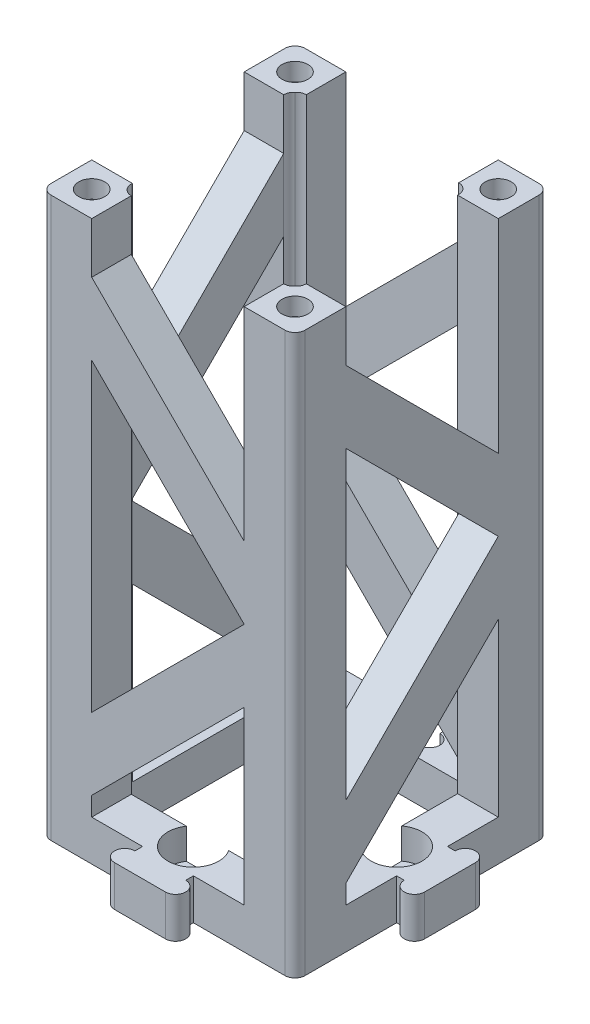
SolidWorks part; units mm, degrees
ref_plane "Front Plane" through (0, 0, 0) normal (0, 0, 1) x (1, 0, 0)
ref_plane "Top Plane" through (0, 0, 0) normal (0, 1, 0) x (1, 0, 0)
ref_plane "Right Plane" through (0, 0, 0) normal (1, 0, 0) x (0, 0, -1)
sketch "Sketch2" plane through (0, 0, 0) normal (0, 1, 0) x (1, 0, 0)
  line L0 (0, -25) -> (0, -20) construction
  line L1 (23, -25) -> (-23, -25)
  line L2 (25, -23) -> (25, 23)
  line L3 (23, 25) -> (5, 25)
  line L4 (-25, -23) -> (-25, -5)
  line L5 (25, -25) -> (-25, 25) construction
  line L6 (25, 25) -> (-25, -25) construction
  line L7 (15, -17.2179) -> (1.25, -17.2179)
  line L8 (17, -15.2179) -> (17, -1.25)
  line L9 (15, 17.2179) -> (-15, 17.2179)
  line L10 (-17, -15.2179) -> (-17, 15.2179)
  line L11 (17, -17.2179) -> (-17, 17.2179) construction
  line L12 (17, 17.2179) -> (-17, -17.2179) construction
  line L13 (25, 0) -> (20, 0) construction
  line L14 (25, 5) -> (26.5, 5)
  line L15 (25, 0) -> (33.3042, 0) construction
  line L16 (25, -5) -> (26.5, -5)
  line L17 (30.5, 5) -> (30.5, -5)
  line L18 (5, -30.5) -> (-5, -30.5)
  line L19 (-5, -25) -> (-5, -26.5)
  line L20 (0, 0) -> (25, -5) construction
  line L21 (0, 0) -> (-5, -25) construction
  line L22 (5, -26.5) -> (5, -25)
  line L23 (0, 25) -> (0, 17.2179) construction
  line L24 (-5, 25) -> (-5, 23.5)
  line L25 (5, 25) -> (5, 23.5)
  line L26 (-5, 19.5) -> (5, 19.5)
  line L27 (-5, 25) -> (-23, 25)
  line L28 (-19.5, -5) -> (-19.5, 5)
  line L29 (-25, 5) -> (-23.5, 5)
  line L30 (-25, -5) -> (-23.5, -5)
  line L31 (-25, 5) -> (-25, 23)
  line L32 (17, 1.25) -> (17, 15.2179)
  line L33 (-1.25, -17.2179) -> (-15, -17.2179)
  arc A0 (23, -25) -> (25, -23) centre (23, -23) ccw
  arc A1 (25, 23) -> (23, 25) centre (23, 23) ccw
  arc A2 (17, 15.2179) -> (15, 17.2179) centre (15, 15.2179) ccw
  arc A3 (15, -17.2179) -> (17, -15.2179) centre (15, -15.2179) ccw
  arc A4 (-15, -17.2179) -> (-17, -15.2179) centre (-15, -15.2179) cw
  arc A5 (-23, -25) -> (-25, -23) centre (-23, -23) cw
  arc A6 (-15, 17.2179) -> (-17, 15.2179) centre (-15, 15.2179) ccw
  arc A7 (-23, 25) -> (-25, 23) centre (-23, 23) ccw
  arc A8 (-1.25, -17.2179) -> (1.25, -17.2179) centre (0, -20) ccw
  arc A9 (17, -1.25) -> (17, 1.25) centre (20, 0) ccw
  arc A10 (26.5, 5) -> (30.5, 5) centre (28.5, 5) cw
  arc A11 (26.5, -5) -> (30.5, -5) centre (28.5, -5) ccw
  arc A12 (-5, -26.5) -> (-5, -30.5) centre (-5, -28.5) ccw
  arc A13 (5, -26.5) -> (5, -30.5) centre (5, -28.5) cw
  arc A14 (-5, 23.5) -> (-5, 19.5) centre (-5, 21.5) ccw
  arc A15 (5, 23.5) -> (5, 19.5) centre (5, 21.5) cw
  arc A16 (-23.5, -5) -> (-19.5, -5) centre (-21.5, -5) ccw
  arc A17 (-23.5, 5) -> (-19.5, 5) centre (-21.5, 5) cw
  circle A18 centre (-20, -20) radius 2.55
  circle A19 centre (-20, 20) radius 2.55
  circle A20 centre (20, 20) radius 2.55
  circle A21 centre (20, -20) radius 2.55
  point P0 (0, 0)
  point P6 (0, 0)
  point P82 (0, 0)
  point P91 (0, 0)
  dimension "D4" = 2
  dimension "D8" = 2
  dimension "D9" = 5.5
  dimension "D14" = 2
  dimension "D20" = 2
  dimension "D25" = 2
  dimension "D26" = 5.1
  dimension "D27" = 5.1
  dimension "D33" = 6.1
  dimension "D34" = 6.5
  dimension "D1" = 50
  dimension "D2" = 50
  dimension "D3" = 34
  dimension "D5" = 5
  dimension "D6" = 5
  dimension "D7" = 10
  dimension "D10" = 2
  dimension "D11" = 90
  dimension "D12" = 1.5
  dimension "D13" = 10
  dimension "D15" = 10
  dimension "D16" = 5
  dimension "D17" = 5
  dimension "D18" = 10
  dimension "D19" = 1.5
  dimension "D22" = 1.5
  dimension "D23" = 20
  dimension "D24" = 10
  dimension "D28" = 5
  dimension "D29" = 4
  dimension "D30" = 5
  dimension "D31" = 5
  dimension "D32" = 5
  dimension "D35" = 13.75
  dimension "D21" = 2
extrude "Boss-Extrude2" add sketch "Sketch2" along normal blind 8 contours L29 A17 L28 A16 L30 L4 A5 L1 A0 L2 A1 L3 L25 A15 L26 A14 L24 L27 A7 L31 A21 A20 A19 A18 A9 L8 A3 L7 A8 L33 A4 L10 A6 L9 A2 L32 | A13 L22 L1 L19 A12 L18 | L16 A11 L17 A10 L14 L2
sketch "Sketch3" plane through (0, 8, 0) normal (0, 1, 0) x (1, 0, 0)
  circle A0 centre (0, -20) radius 5
  circle A1 centre (20, 0) radius 5
  dimension "D1" = 10
extrude "Cut-Extrude1" cut sketch "Sketch3" against normal blind 6
sketch "Sketch5" plane through (0, 0, 0) normal (0, -1, 0) x (1, 0, 0)
  circle A0 centre (-20, 20) radius 3
  circle A1 centre (20, 20) radius 3
  circle A2 centre (20, -20) radius 3
  circle A3 centre (-20, -20) radius 3
  dimension "D1" = 6
extrude "Boss-Extrude3" add sketch "Sketch5" against normal blind 4.5
sketch "Sketch6" plane through (0, 8, 0) normal (0, 1, 0) x (1, 0, 0)
  line L0 (-5, -25) -> (-23, -25) construction
  line L1 (-17, -15) -> (-25, -15)
  line L2 (-15, -17.2179) -> (-15, -25)
  line L3 (-15, -25) -> (-23, -25)
  line L4 (-25, -15) -> (-25, -23)
  line L5 (-16.519, -16.519) -> (-24.4142, -24.4142) construction
  line L6 (-15, -25) -> (-25, -15) construction
  line L7 (-25, -23) -> (-25, -5) construction
  line L8 (-4.1545, -17.2179) -> (-15, -17.2179) construction
  line L9 (-17, -15.2179) -> (-17, 15.2179) construction
  line L10 (-4.1545, -17.2179) -> (-15, -17.2179)
  line L11 (-17, -15.2179) -> (-17, -15)
  line L12 (-15.2179, 17) -> (-15, 17)
  line L13 (-15, 17) -> (-15, 25)
  line L14 (-15, 25) -> (-23, 25)
  line L15 (-25, 15) -> (-25, 23)
  line L16 (-17.2179, 15) -> (-25, 15)
  line L17 (17, 15.2179) -> (17, 15)
  line L18 (17, 15) -> (25, 15)
  line L19 (25, 15) -> (25, 23)
  line L20 (15, 25) -> (23, 25)
  line L21 (15, 17.2179) -> (15, 25)
  line L22 (15.2179, -17) -> (15, -17)
  line L23 (15, -17) -> (15, -25)
  line L24 (15, -25) -> (23, -25)
  line L25 (25, -15) -> (25, -23)
  line L26 (17.2179, -15) -> (25, -15)
  arc A0 (-25, -23) -> (-23, -25) centre (-23, -23) ccw construction
  arc A1 (-17, -15.2179) -> (-15, -17.2179) centre (-15, -15.2179) ccw construction
  arc A2 (-25, -23) -> (-23, -25) centre (-23, -23) ccw
  arc A3 (-17, -15.2179) -> (-15, -17.2179) centre (-15, -15.2179) ccw
  circle A4 centre (0, 0) radius 9.4075 construction
  arc A5 (-15.2179, 17) -> (-17.2179, 15) centre (-15.2179, 15) ccw
  arc A6 (-23, 25) -> (-25, 23) centre (-23, 23) ccw
  arc A7 (17, 15.2179) -> (15, 17.2179) centre (15, 15.2179) ccw
  arc A8 (25, 23) -> (23, 25) centre (23, 23) ccw
  arc A9 (15.2179, -17) -> (17.2179, -15) centre (15.2179, -15) ccw
  arc A10 (23, -25) -> (25, -23) centre (23, -23) ccw
  point P0 (-20, -20)
  point P52 (0, 0)
  dimension "D1" = 4
extrude "Boss-Extrude4" add sketch "Sketch6" along normal blind 102 contours L2 L1 M11 M12 M30 M31 M32 M24 | A9 L23 L26 M19 M38 M39 M40 M21 | L21 L18 M15 M16 M46 M47 M48 M22 | A5 L13 L16 M13 M54 M55 M56 M23
sketch "Sketch7" plane through (0, 8, 0) normal (0, 1, 0) x (1, 0, 0)
  circle A0 centre (-20, 20) radius 2.55
  circle A1 centre (-20, -20) radius 2.55
  circle A2 centre (20, -20) radius 2.55
  circle A3 centre (20, 20) radius 2.55
extrude "Boss-Extrude5" add sketch "Sketch7" along normal blind 98.5
sketch "Sketch8" plane through (25, 0, 0) normal (1, 0, 0) x (0, 0, -1)
  line L0 (-15, 8) -> (-15, 59) construction
  line L1 (-15, 110) -> (-15, 8) construction
  line L2 (-15, 11.7157) -> (15, 41.7157)
  line L3 (15, 110) -> (15, 8) construction
  line L4 (15, 41.7157) -> (15, 55.8579)
  line L5 (15, 70) -> (-15, 100)
  line L6 (-15, 25.8579) -> (15, 55.8579)
  line L7 (-15, 11.7157) -> (-15, 25.8579)
  line L8 (15, 55.8579) -> (-15, 85.8579)
  line L10 (-15, 100) -> (-15, 85.8579)
  line L11 (15, 70) -> (15, 55.8579)
  dimension "D1" = 10
  dimension "D2" = 10
  dimension "D3" = 135
  dimension "D4" = 45
  dimension "D5" = 10
extrude "Boss-Extrude8" add sketch "Sketch8" against normal up to vertex (10 mm away) contours L11 L5 L4 L8 | L6 L4 L2
sketch "Sketch12" plane through (0, 0, -25) normal (0, 0, -1) x (-1, 0, 0)
  line L0 (-15, 8) -> (-15, 59) construction
  line L1 (-15, 11.7157) -> (15, 41.7157)
  line L2 (15, 41.7157) -> (15, 55.8579)
  line L3 (15, 70) -> (-15, 100)
  line L4 (-15, 25.8579) -> (15, 55.8579)
  line L5 (-15, 11.7157) -> (-15, 25.8579)
  line L6 (15, 55.8579) -> (-15, 85.8579)
  line L7 (-15, 100) -> (-15, 85.8579)
  line L8 (15, 70) -> (15, 55.8579)
  line L9 (15, 110) -> (15, 8) construction
  line L10 (-15, 110) -> (-15, 8) construction
  dimension "D1" = 10
  dimension "D2" = 135
  dimension "D3" = 10
  dimension "D4" = 10
  dimension "D5" = 45
extrude "Boss-Extrude9" add sketch "Sketch12" against normal up to vertex (7.7821 mm away) contours L4 L1 L2 M12 | L6 L7 L3 L8
sketch "Sketch13" plane through (-25, 0, 0) normal (-1, 0, 0) x (0, 0, 1)
  line L0 (-15, 8) -> (-15, 59) construction
  line L1 (-15, 11.7157) -> (15, 41.7157)
  line L2 (15, 41.7157) -> (15, 55.8579)
  line L3 (15, 70) -> (-15, 100)
  line L4 (-15, 25.8579) -> (15, 55.8579)
  line L5 (-15, 11.7157) -> (-15, 25.8579)
  line L6 (15, 55.8579) -> (-15, 85.8579)
  line L7 (-15, 100) -> (-15, 85.8579)
  line L8 (15, 70) -> (15, 55.8579)
  line L10 (-15, 110) -> (-15, 8) construction
  line L11 (15, 110) -> (15, 8) construction
  dimension "D1" = 10
  dimension "D2" = 135
  dimension "D3" = 10
  dimension "D4" = 45
  dimension "D5" = 10
extrude "Boss-Extrude10" add sketch "Sketch13" against normal up to vertex (7.7821 mm away) contours L8 L3 L6 M12 | L4 L1 L2 M12
sketch "Sketch14" plane through (0, 0, 25) normal (0, 0, 1) x (1, 0, 0)
  line L0 (-15, 14.3144) -> (-15, 65.3144) construction
  line L1 (-15, 11.7157) -> (15, 41.7157)
  line L2 (15, 41.7157) -> (15, 55.8579)
  line L3 (15, 70) -> (-15, 100)
  line L4 (-15, 25.8579) -> (15, 55.8579)
  line L5 (-15, 11.7157) -> (-15, 25.8579)
  line L6 (15, 55.8579) -> (-15, 85.8579)
  line L7 (-15, 100) -> (-15, 85.8579)
  line L8 (15, 70) -> (15, 55.8579)
  line L9 (-15, 110) -> (-15, 8) construction
  line L10 (15, 110) -> (15, 8) construction
  dimension "D1" = 10
  dimension "D2" = 135
  dimension "D3" = 10
  dimension "D4" = 45
  dimension "D5" = 10
extrude "Boss-Extrude11" add sketch "Sketch14" against normal up to vertex (7.7821 mm away) contours L8 L3 L6 M12 | L4 L5 L1 L2 M12
